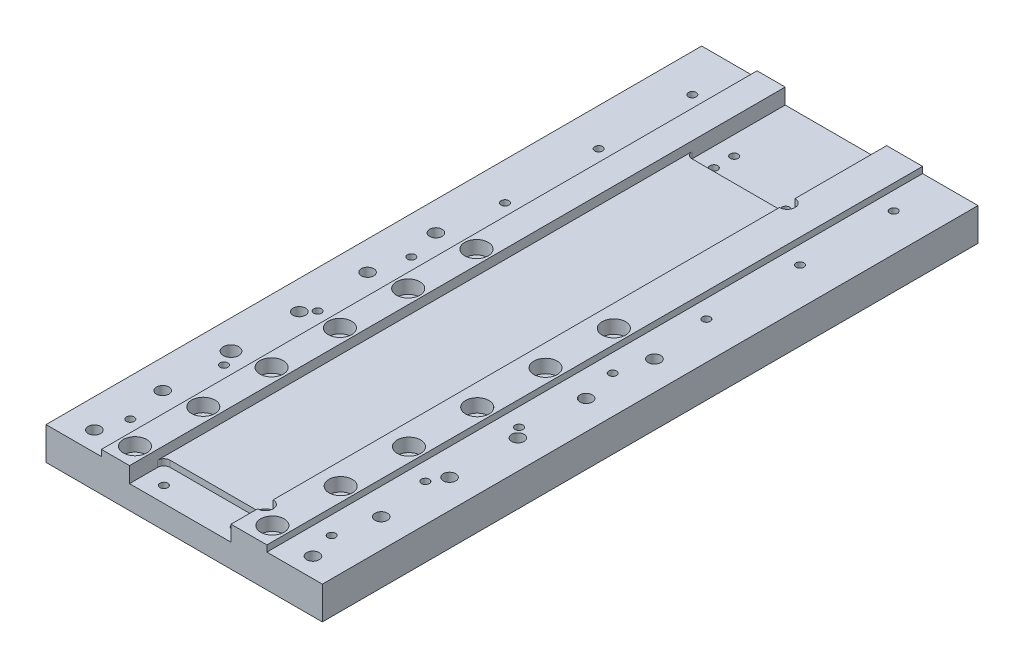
SolidWorks part; units mm, degrees
ref_plane "Ebene vorne" through (0, 0, 0) normal (0, 0, 1) x (1, 0, 0)
ref_plane "Ebene oben" through (0, 0, 0) normal (0, 1, 0) x (1, 0, 0)
ref_plane "Ebene rechts" through (0, 0, 0) normal (1, 0, 0) x (0, 0, -1)
sketch "Skizze1" plane through (0, 0, 0) normal (0, 0, 1) x (1, 0, 0)
  line L1 (0, 0) -> (177, 0)
  line L2 (0, 0) -> (0, 25)
  line L3 (0, 25) -> (177, 25)
  line L4 (177, 0) -> (177, 25)
  dimension "D1" = 177
  dimension "D2" = 25
extrude "Aufsatz-Linear austragen1" add sketch "Skizze1" along normal blind 420
sketch "Skizze2" plane through (0, 25, 0) normal (0, 1, 0) x (1, 0, 0)
  line L0 (177, -420) -> (0, -420) construction
  line L1 (0, 0) -> (35.5, 0)
  line L2 (0, 0) -> (0, -420)
  line L3 (0, -420) -> (35.5, -420)
  line L4 (35.5, 0) -> (35.5, -420)
  line L5 (177, 0) -> (0, 0) construction
  line L6 (177, -420) -> (141.5, -420)
  line L7 (177, -420) -> (177, 0)
  line L8 (177, 0) -> (141.5, 0)
  line L9 (141.5, -420) -> (141.5, 0)
  dimension "D1" = 35.5
  dimension "D2" = 35.5
extrude "Schnitt-Linear austragen1" cut sketch "Skizze2" against normal blind 4
sketch "Skizze3" plane through (0, 25, 0) normal (0, 1, 0) x (1, 0, 0)
  line L0 (141.5, -420) -> (35.5, -420) construction
  line L1 (53.5, -420) -> (118.5, -420)
  line L2 (53.5, -420) -> (53.5, -398)
  line L3 (53.5, -398) -> (118.5, -398)
  line L4 (118.5, -420) -> (118.5, -398)
  line L5 (177, -420) -> (177, 0) construction
  dimension "D1" = 65
  dimension "D2" = 22
  dimension "D3" = 58.5
extrude "Schnitt-Linear austragen2" cut sketch "Skizze3" against normal blind 10
sketch "Skizze4" plane through (0, 25, 0) normal (0, 1, 0) x (1, 0, 0)
  circle A0 centre (118.5, -398) radius 5
  dimension "D1" = 10
extrude "Schnitt-Linear austragen3" cut sketch "Skizze4" against normal blind 10
fillet "Verrundung1" radius 4 1 edges at (53.5, 20, 398)
sketch "Skizze6" plane through (0, 25, 0) normal (0, 1, 0) x (1, 0, 0)
  line L0 (141.5, 0) -> (35.5, 0) construction
  line L1 (118.5, -420) -> (53.5, -420)
  line L2 (118.5, -420) -> (118.5, 0)
  line L3 (118.5, 0) -> (53.5, 0)
  line L4 (53.5, -420) -> (53.5, 0)
  line L5 (53.5, -63.7) -> (118.5, -63.7)
  dimension "D1" = 65
  dimension "D2" = 63.7
extrude "Schnitt-Linear austragen4" cut sketch "Skizze6" against normal blind 10 contours L4 L5 L2 M8
sketch "Skizze7" plane through (0, 25, 0) normal (0, 1, 0) x (1, 0, 0)
  circle A0 centre (118.5, -63.7) radius 5
  dimension "D1" = 10
extrude "Schnitt-Linear austragen5" cut sketch "Skizze7" against normal blind 10
fillet "Verrundung2" radius 4 1 edges at (53.5, 20, 63.7)
sketch "Skizze8" plane through (0, 21, 0) normal (0, 1, 0) x (1, 0, 0)
  line L0 (24, -90) -> (153, -90)
  line L1 (24, -30) -> (153, -30)
  line L2 (24, -30) -> (24, -390)
  line L3 (24, -390) -> (153, -390)
  line L4 (153, -30) -> (153, -390)
  line L5 (24, -150) -> (153, -150)
  line L6 (24, -270) -> (153, -270)
  line L7 (24, -330) -> (153, -330)
  line L8 (24, -210) -> (153, -210)
  line L9 (35.5, 0) -> (0, 0) construction
  line L11 (35.5, -420) -> (35.5, 0) construction
  line L12 (141.5, 0) -> (141.5, -420) construction
  dimension "D1" = 60
  dimension "D2" = 60
  dimension "D3" = 60
  dimension "D4" = 60
  dimension "D5" = 60
  dimension "D6" = 60
  dimension "D7" = 30
  dimension "D8" = 11.5
  dimension "D9" = 11.5
hole_wizard "M6 Gewindebohrung1" positions "Skizze10" profile "Skizze9" tap size "M6" standard "ISO"
sketch "Skizze10" plane through (0, 21, 0) normal (0, 1, 0) x (1, 0, 0)
  point P0 (24, -90)
  point P4 (24, -30)
  point P8 (24, -150)
  point P12 (24, -210)
  point P16 (24, -270)
  point P20 (24, -330)
  point P24 (24, -390)
  point P28 (153, -390)
  point P32 (153, -330)
  point P36 (153, -270)
  point P40 (153, -210)
  point P44 (153, -150)
  point P48 (153, -90)
  point P52 (153, -30)
sketch "Skizze9" plane through (24, 21, 90) normal (1, 0, 0) x (0, 0, 1)
  line L0 (0, 0) -> (0, 20.5022)
  line L1 (0, 20.5022) -> (2.5, 19)
  line L2 (2.5, 19) -> (2.5, 0)
  line L5 (2.5, 0) -> (0, 0)
  line L10 (0, 20.5022) -> (-2.5, 19) construction
  line L11 (0, -6.35) -> (0, 107.95) construction
  dimension "Bohrerdurchmesser" = 5
  dimension "Bohrungstiefe" = 19
  dimension "Spitzenwinkel" = 118
sketch "Skizze11" plane through (0, 15, 0) normal (0, 1, 0) x (1, 0, 0)
  line L0 (53.5, -420) -> (118.5, -420) construction
  line L1 (65.5, -420) -> (111.5, -420)
  line L2 (65.5, -420) -> (65.5, -410)
  line L3 (65.5, -410) -> (111.5, -410)
  line L4 (111.5, -420) -> (111.5, -410)
  line L5 (118.5, -420) -> (118.5, -403) construction
  line L6 (118.5, -58.7) -> (118.5, 0) construction
  line L7 (65.5, -44.7) -> (111.5, -44.7)
  line L8 (65.5, -44.7) -> (65.5, -57.7)
  line L9 (65.5, -57.7) -> (111.5, -57.7)
  line L10 (111.5, -44.7) -> (111.5, -57.7)
  line L11 (118.5, 0) -> (53.5, 0) construction
  dimension "D1" = 46
  dimension "D2" = 10
  dimension "D3" = 7
  dimension "D4" = 46
  dimension "D5" = 7
  dimension "D6" = 13
  dimension "D7" = 44.7
hole_wizard "M6 Gewindebohrung2" positions "Skizze13" profile "Skizze12" tap size "M6" standard "ISO"
sketch "Skizze13" plane through (0, 15, 0) normal (0, 1, 0) x (1, 0, 0)
  point P0 (65.5, -44.7)
  point P4 (111.5, -44.7)
  point P8 (65.5, -57.7)
  point P12 (111.5, -57.7)
  point P16 (65.5, -410)
  point P20 (111.5, -410)
sketch "Skizze12" plane through (65.5, 15, 44.7) normal (1, 0, 0) x (0, 0, 1)
  line L0 (0, 0) -> (0, 14.5022)
  line L1 (0, 14.5022) -> (2.5, 13)
  line L2 (2.5, 13) -> (2.5, 0)
  line L5 (2.5, 0) -> (0, 0)
  line L10 (0, 14.5022) -> (-2.5, 13) construction
  line L11 (0, -6.35) -> (0, 107.95) construction
  dimension "Bohrerdurchmesser" = 5
  dimension "Bohrungstiefe" = 13
  dimension "Spitzenwinkel" = 118
sketch "Skizze14" plane through (0, 25, 0) normal (0, 1, 0) x (1, 0, 0)
  line L0 (53.5, -59.7) -> (53.5, 0) construction
  line L1 (53.5, -52.2927) -> (118.5, -52.2927)
  line L2 (53.5, -52.2927) -> (53.5, -411.5)
  line L3 (53.5, -411.5) -> (118.5, -411.5)
  line L4 (118.5, -52.2927) -> (118.5, -411.5)
  line L5 (118.5, -420) -> (118.5, -403) construction
extrude "Schnitt-Linear austragen6" cut sketch "Skizze14" against normal blind 6
sketch "Skizze15" plane through (0, 21, 0) normal (0, 1, 0) x (1, 0, 0)
  line L0 (0, -420) -> (35.5, -420) construction
  line L1 (141.5, -420) -> (177, -420) construction
  line L2 (0, 0) -> (0, -420) construction
  circle A0 centre (18.5, -407.5) radius 4
  circle A1 centre (158.5, -407.5) radius 4
  dimension "D1" = 8
  dimension "D2" = 8
  dimension "D3" = 12.5
  dimension "D4" = 12.5
  dimension "D5" = 140
  dimension "D6" = 18.5
extrude "Schnitt-Linear austragen7" cut sketch "Skizze15" against normal blind 33
sketch "Skizze16" plane through (0, 21, 0) normal (0, 1, 0) x (1, 0, 0)
  line L0 (18.5, -232.5) -> (158.5, -232.5)
  line L1 (0, -420) -> (177, -420) construction
  line L2 (0, 0) -> (0, -420) construction
  circle A1 centre (18.5, -232.5) radius 4
  circle A2 centre (158.5, -232.5) radius 4
  point P2 (88.5, -420)
  dimension "D3" = 18.5
  dimension "D4" = 8
  dimension "D5" = 8
  dimension "D1" = 187.5
  dimension "D2" = 140
extrude "Schnitt-Linear austragen8" cut sketch "Skizze16" against normal blind 33
sketch "Skizze17" plane through (0, 25, 0) normal (0, 1, 0) x (1, 0, 0)
  line L0 (44.5, -407.5) -> (132.5, -407.5)
  line L1 (44.5, -232.5) -> (132.5, -232.5)
  line L2 (0, 0) -> (0, -420) construction
  line L4 (53.5, -420) -> (35.5, -420) construction
  dimension "D1" = 88
  dimension "D2" = 44.5
  dimension "D3" = 88
  dimension "D4" = 44.5
  dimension "D5" = 12.5
  dimension "D6" = 187.5
hole_wizard "Stirnsenkung für M8 Zylinderschraube mit Innensechskant1" positions "Skizze20" profile "Skizze18" counterbore size "M8" standard "ISO"
sketch "Skizze20" plane through (0, 25, 0) normal (0, 1, 0) x (1, 0, 0)
  point P0 (44.5, -232.5)
  point P4 (44.5, -407.5)
  point P8 (132.5, -407.5)
  point P12 (132.5, -232.5)
sketch "Skizze18" plane through (44.5, 25, 232.5) normal (1, 0, 0) x (0, 0, 1)
  line L0 (0, 0) -> (0, 32.7039)
  line L1 (0, 32.7039) -> (4.5, 30)
  line L2 (4.5, 30) -> (4.5, 8.6)
  line L3 (4.5, 8.6) -> (7.5, 8.6)
  line L4 (7.5, 8.6) -> (7.5, 0)
  line L5 (7.5, 0) -> (0, 0)
  line L10 (0, 32.7039) -> (-4.5, 30) construction
  line L11 (0, -6.35) -> (0, 107.95) construction
  dimension "Bohrerdurchmesser" = 9
  dimension "Bohrungstiefe" = 30
  dimension "Senkdurchmesser2" = 15
  dimension "Senktiefe2" = 8.6
  dimension "Spitzenwinkel" = 118
sketch "Skizze21" plane through (0, 0, 0) normal (0, -1, 0) x (-1, 0, 0)
  line L0 (-132.5, -232.5) -> (-132.5, -407.5)
  line L1 (-44.5, -232.5) -> (-44.5, -407.5)
  line L2 (-158.5, -232.5) -> (-158.5, -407.5)
  line L3 (-18.5, -232.5) -> (-18.5, -407.5)
  line L4 (-167.1421, -276.25) -> (-11.2192, -276.25)
  line L5 (-167.1421, -320) -> (-11.2192, -320)
  line L6 (-165.0887, -363.75) -> (-11.2192, -363.75)
  line L7 (-158.5, -232.5) -> (-158.5, -186.0522)
  line L8 (-132.5, -232.5) -> (-132.5, -186.0522)
  line L9 (-44.5, -232.5) -> (-44.5, -186.0522)
  line L10 (-18.5, -232.5) -> (-18.5, -186.0522)
  line L11 (-167.1421, -188.75) -> (-11.2192, -188.75)
  circle A0 centre (-158.5, -188.75) radius 4
  circle A1 centre (-158.5, -276.25) radius 4
  circle A2 centre (-158.5, -320) radius 4
  circle A3 centre (-158.5, -363.75) radius 4
  circle A4 centre (-18.5, -363.75) radius 4
  circle A5 centre (-18.5, -320) radius 4.9308
  circle A6 centre (-18.5, -276.25) radius 4
  circle A7 centre (-18.5, -188.75) radius 4
  dimension "D5" = 8
  dimension "D6" = 8
  dimension "D7" = 8
  dimension "D8" = 8
  dimension "D9" = 8
  dimension "D10" = 8
  dimension "D11" = 9.8616
  dimension "D12" = 8
  dimension "D1" = 43.75
  dimension "D2" = 43.75
  dimension "D3" = 43.75
  dimension "D4" = 43.75
extrude "Schnitt-Linear austragen10" cut sketch "Skizze21" against normal blind 187
sketch "Skizze22" plane through (0, 0, 0) normal (0, -1, 0) x (-1, 0, 0)
  line L0 (-132.5, -232.5) -> (-132.5, -407.5)
  line L1 (-132.5, -407.5) -> (-132.5, -172.0013)
  line L2 (-44.5, -232.5) -> (-44.5, -407.5)
  line L3 (-44.5, -407.5) -> (-44.5, -172.0013)
  line L4 (-158.5, -188.75) -> (-18.5, -188.75)
  line L5 (-158.5, -276.25) -> (-18.5, -276.25)
  line L6 (-158.5, -320) -> (-18.5, -320)
  line L7 (-158.5, -363.75) -> (-18.5, -363.75)
  circle A0 centre (-132.5, -188.75) radius 4.5
  circle A1 centre (-44.5, -188.75) radius 4.5
  circle A2 centre (-132.5, -276.25) radius 4.5
  circle A3 centre (-44.5, -276.25) radius 4.5
  circle A4 centre (-132.5, -320) radius 4.5
  circle A5 centre (-44.5, -320) radius 4.5
  circle A6 centre (-132.5, -363.75) radius 4.5
  circle A7 centre (-44.5, -363.75) radius 4.5
  dimension "D1" = 9
  dimension "D2" = 9
  dimension "D3" = 9
  dimension "D4" = 9
  dimension "D5" = 9
  dimension "D6" = 9
  dimension "D7" = 9
  dimension "D8" = 9
extrude "Schnitt-Linear austragen11" cut sketch "Skizze22" against normal blind 187 contours L1 A0 L4 | L4 A0 L1 | L1 A0 L4 | L4 A0 L1 | A1 | A3 | A2 | A5 | A4 | A6 | A7
sketch "Skizze23" plane through (0, 25, 0) normal (0, 1, 0) x (1, 0, 0)
  circle A0 centre (44.5, -188.75) radius 7.5
  circle A1 centre (132.5, -188.75) radius 7.5
  circle A2 centre (132.5, -276.25) radius 7.5
  circle A3 centre (132.5, -320) radius 7.5
  circle A4 centre (44.5, -276.25) radius 7.5
  circle A5 centre (44.5, -320) radius 7.5
  circle A6 centre (44.5, -363.75) radius 7.5
  circle A7 centre (132.5, -363.75) radius 7.5
  dimension "D1" = 15
  dimension "D2" = 15
  dimension "D3" = 15
  dimension "D4" = 15
  dimension "D5" = 15
  dimension "D6" = 15
  dimension "D7" = 15
  dimension "D8" = 15
extrude "Schnitt-Linear austragen12" cut sketch "Skizze23" against normal blind 8.6
